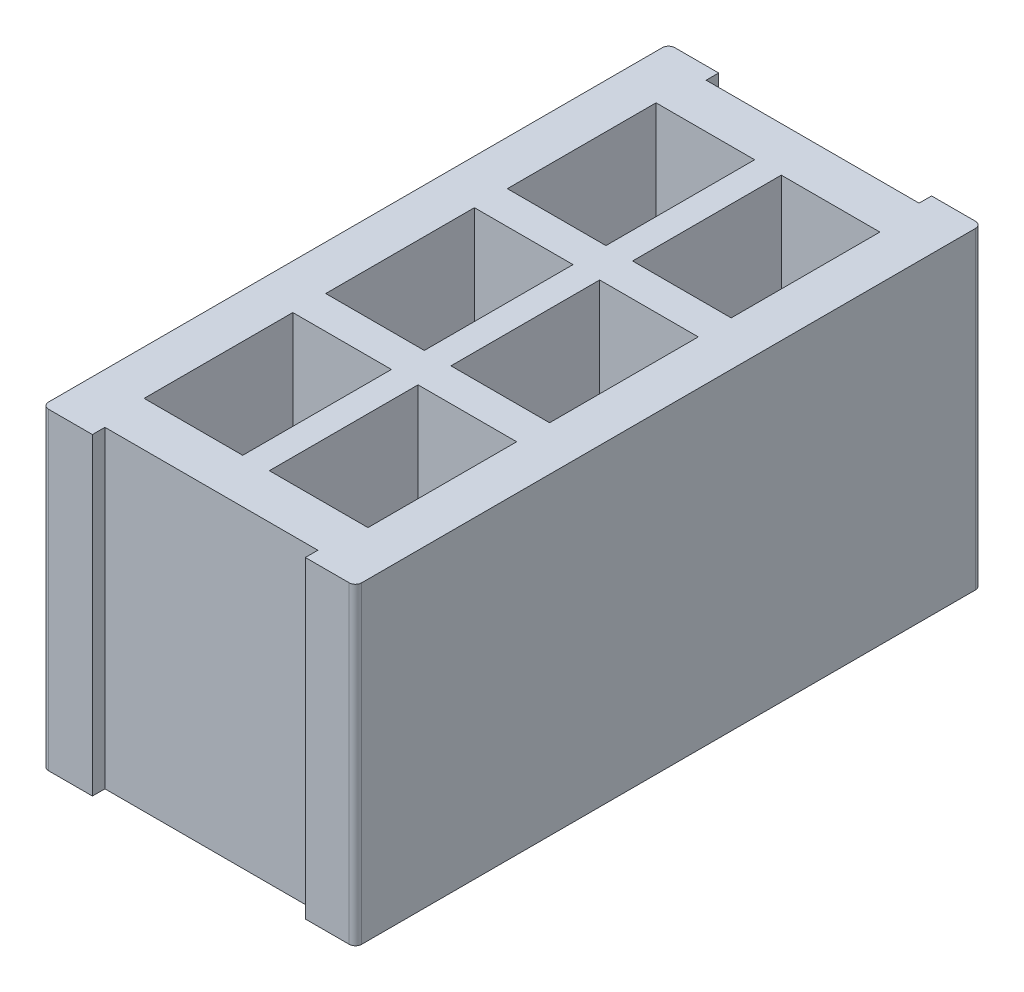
SolidWorks part; units mm, degrees
ref_plane "Plan de face" through (0, 0, 0) normal (0, 0, 1) x (1, 0, 0)
ref_plane "Plan de dessus" through (0, 0, 0) normal (0, 1, 0) x (1, 0, 0)
ref_plane "Plan de droite" through (0, 0, 0) normal (1, 0, 0) x (0, 0, -1)
sketch "Esquisse1" plane through (0, 0, 0) normal (0, 1, 0) x (1, 0, 0)
  line L0 (0, -20.2628) -> (0, 58.4186) construction
  line L1 (-24.3225, 0) -> (29.7425, 0) construction
  line L2 (25, -20.2628) -> (25, 58.4186) construction
  line L3 (-24.3225, 50) -> (34.6841, 50) construction
  line L4 (4, 55.6667) -> (4, -3.7395) construction
  line L5 (-3.5126, 49) -> (27.2256, 49) construction
  line L6 (-17.7609, 25) -> (23.5775, 25) construction
  line L7 (12.5, 55.6667) -> (12.5, -13.5587) construction
  line L8 (21, 0) -> (24.5, 0)
  line L9 (21, 55.6667) -> (21, -3.7395) construction
  line L10 (-3.5126, 1) -> (27.2256, 1) construction
  line L11 (4, 49) -> (21, 49)
  line L12 (4, 49) -> (4, 50)
  line L14 (21, 49) -> (21, 50)
  line L15 (4, 1) -> (21, 1)
  line L16 (4, 1) -> (4, 0)
  line L17 (21, 50) -> (24.5, 50)
  line L18 (21, 1) -> (21, 0)
  line L19 (0.5, 50) -> (4, 50)
  line L20 (0, 49.5) -> (0, 0.5)
  line L21 (0.5, 0) -> (4, 0)
  line L22 (25, 49.5) -> (25, 0.5)
  arc A0 (0.5, 50) -> (0, 49.5) centre (0.5, 49.5) ccw
  arc A1 (24.5, 50) -> (25, 49.5) centre (24.5, 49.5) cw
  arc A2 (24.5, 0) -> (25, 0.5) centre (24.5, 0.5) ccw
  arc A3 (0, 0.5) -> (0.5, 0) centre (0.5, 0.5) ccw
  dimension "D6" = 0.5
  dimension "D1" = 25
  dimension "D2" = 50
  dimension "D3" = 25
  dimension "D4" = 12.5
  dimension "D5" = 4
  dimension "D7" = 1
extrude "Extrusion1" add sketch "Esquisse1" along normal blind 25
sketch "Esquisse2" plane through (0, 0, 0) normal (0, -1, 0) x (1, 0, 0)
  line L0 (0, 2.4119) -> (0, -60.8727) construction
  line L1 (-5.7031, 0) -> (29.0572, 0) construction
  line L2 (29.0572, -25) -> (-5.7031, -25) construction
  line L3 (12.5, 9.4676) -> (12.5, -60.8727) construction
  line L4 (4, 9.4676) -> (4, -52.8814) construction
  line L5 (14, -16) -> (14, -5)
  line L6 (-5.7031, -5) -> (39.022, -5) construction
  line L7 (-5.7031, -16) -> (39.022, -16) construction
  line L8 (-5.7031, -19.5) -> (39.022, -19.5) construction
  line L9 (11, -52.8814) -> (11, 9.4676) construction
  line L10 (-5.7031, -45) -> (39.022, -45) construction
  line L11 (-5.7031, -34) -> (39.022, -34) construction
  line L12 (-5.7031, -30.5) -> (39.022, -30.5) construction
  line L13 (4, -45) -> (11, -45)
  line L14 (4, -45) -> (4, -34)
  line L15 (4, -34) -> (11, -34)
  line L16 (11, -45) -> (11, -34)
  line L17 (4, -30.5) -> (11, -30.5)
  line L18 (4, -30.5) -> (4, -19.5)
  line L19 (4, -19.5) -> (11, -19.5)
  line L20 (11, -30.5) -> (11, -19.5)
  line L21 (4, -16) -> (11, -16)
  line L22 (4, -16) -> (4, -5)
  line L23 (4, -5) -> (11, -5)
  line L24 (11, -16) -> (11, -5)
  line L25 (21, -5) -> (14, -5)
  line L26 (21, -16) -> (21, -5)
  line L27 (21, -16) -> (14, -16)
  line L28 (14, -30.5) -> (14, -19.5)
  line L29 (21, -19.5) -> (14, -19.5)
  line L30 (21, -30.5) -> (21, -19.5)
  line L31 (21, -30.5) -> (14, -30.5)
  line L32 (14, -45) -> (14, -34)
  line L33 (21, -34) -> (14, -34)
  line L34 (21, -45) -> (21, -34)
  line L35 (21, -45) -> (14, -45)
  dimension "D1" = 25
  dimension "D2" = 12.5
  dimension "D3" = 1.5
  dimension "D4" = 5
  dimension "D5" = 11
  dimension "D6" = 3.5
  dimension "D7" = 4
extrude "Enlèv. mat.-Extru.1" cut sketch "Esquisse2" against normal blind 25 draft 1
